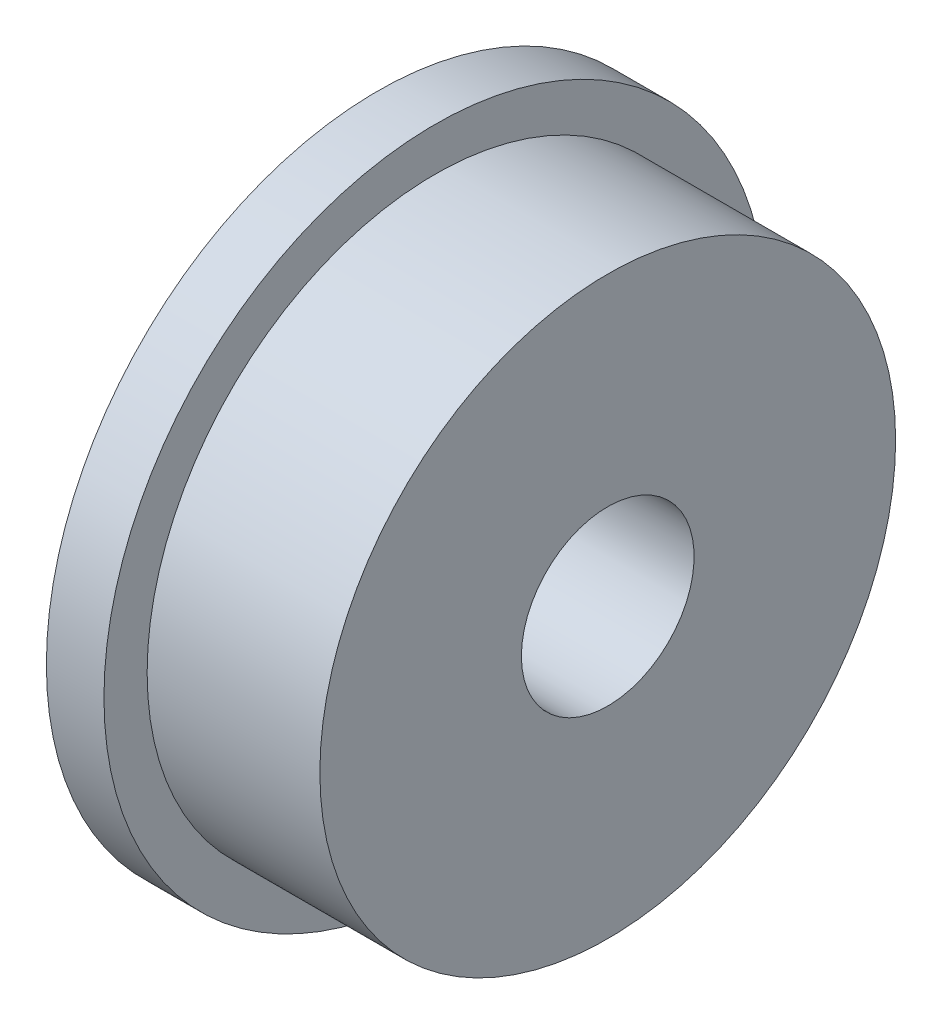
SolidWorks part; units mm, degrees
ref_plane "Front" through (0, 0, 0) normal (0, 0, 1) x (1, 0, 0)
ref_plane "Top" through (0, 0, 0) normal (0, 1, 0) x (1, 0, 0)
ref_plane "Right" through (0, 0, 0) normal (1, 0, 0) x (0, 0, -1)
sketch "Esquisse1" plane through (0, 0, 0) normal (0, 1, 0) x (1, 0, 0)
  line L0 (0, 0) -> (6.746, 0) construction
  line L1 (0, 1.5) -> (0, 5.75)
  line L2 (0, 5.75) -> (1, 5.75)
  line L3 (1, 5.75) -> (1, 5)
  line L4 (1, 5) -> (4, 5)
  line L5 (4, 5) -> (4, 1.5)
  line L6 (4, 1.5) -> (0, 1.5)
  dimension "D1" = 3
  dimension "D2" = 10
  dimension "D3" = 11.5
  dimension "D4" = 1
  dimension "D5" = 4
revolve "Révolution1" add sketch "Esquisse1" angle 360 about L0
